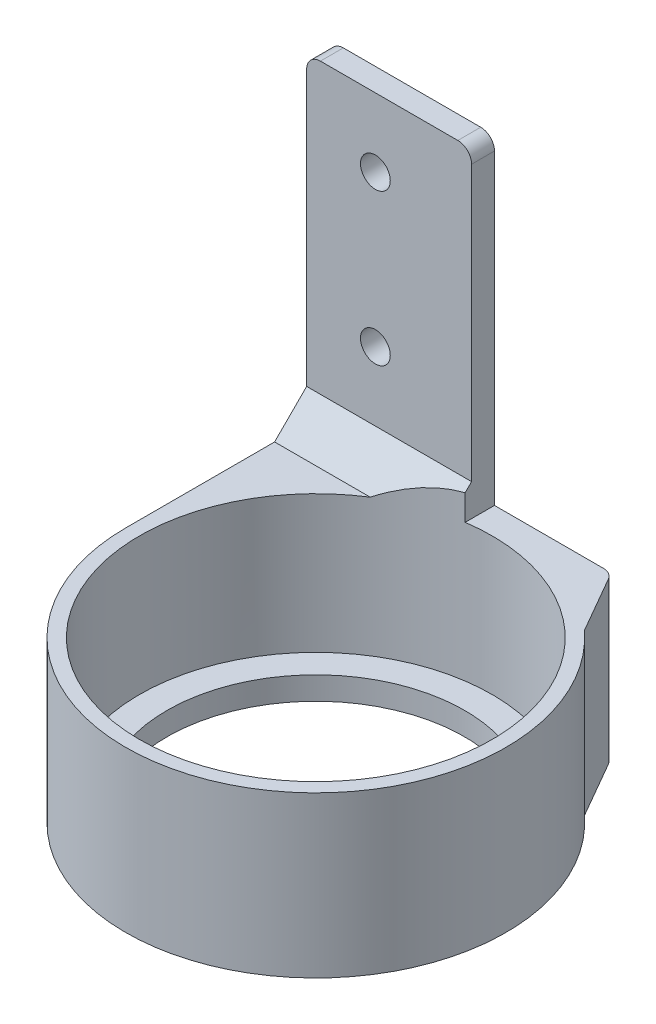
SolidWorks part; units mm, degrees
ref_plane "Ebene vorne" through (0, 0, 0) normal (0, 0, 1) x (1, 0, 0)
ref_plane "Ebene oben" through (0, 0, 0) normal (0, 1, 0) x (1, 0, 0)
ref_plane "Ebene rechts" through (0, 0, 0) normal (1, 0, 0) x (0, 0, -1)
sketch "Skizze1" plane through (0, 0, 0) normal (0, 0, 1) x (1, 0, 0)
  line L0 (18, 0) -> (18, -105) construction
  line L1 (3, 0) -> (33, 0)
  line L2 (0, -3) -> (0, -97)
  line L3 (3, -105) -> (33, -105)
  line L4 (36, -3) -> (36, -97)
  line L5 (0, -63) -> (36, -63) construction
  line L6 (33, -105) -> (36, -105)
  line L7 (36, -105) -> (36, -97)
  line L8 (0, -97) -> (0, -105)
  line L9 (0, -105) -> (3, -105)
  circle A2 centre (15, -15) radius 3.25
  circle A3 centre (15, -48) radius 3.25
  arc A6 (3, 0) -> (0, -3) centre (3, -3) ccw
  arc A7 (33, 0) -> (36, -3) centre (33, -3) cw
  point P18 (36, -105)
  point P21 (0, 0)
  point P24 (36, 0)
  dimension "D3" = 15
  dimension "D4" = 15
  dimension "D5" = 6.5
  dimension "D6" = 6.5
  dimension "D7" = 15
  dimension "D1" = 36
  dimension "D2" = 105
  dimension "D8" = 42
  dimension "D9" = 15
extrude "Aufsatz-Linear austragen1" add sketch "Skizze1" along normal blind 3
sketch "Skizze4" plane through (0, -105, 0) normal (0, -1, 0) x (1, 0, 0)
  line L0 (0, 3) -> (36, 3) construction
  line L1 (0, -20.5722) -> (0, 101.0705) construction
  line L2 (41.5, 44.5) -> (-50.319, 44.5) construction
  circle A0 centre (41.5, 44.5) radius 41.5
  point P7 (0, 44.5)
other "AusrichtungGruppe1" parameters "D1"=51.6821, "D2"=82, "D3"=82
extrude "Aufsatz-Linear austragen2" add sketch "Skizze4" against normal blind 35 separate body
sketch "Skizze6" plane through (0, -105, 0) normal (0, -1, 0) x (-1, 0, 0)
  circle A0 centre (-41.5, -44.5) radius 38.5
  dimension "D1" = 77
extrude "Schnitt-Linear austragen1" cut sketch "Skizze6" against normal through all
sketch "Skizze7" plane through (0, -70, 0) normal (0, 1, 0) x (1, 0, 0)
  circle A0 centre (41.5, -44.5) radius 32.5
  dimension "D1" = 65
extrude "Linear-Austragen-Dünn1" add sketch "Skizze7" against normal blind 5 from offset 30 thin
sketch "Skizze16" plane through (0, 0, 0) normal (0, 0, -1) x (-1, 0, 0)
  line L0 (0, -70) -> (-83, -70) construction
  line L1 (-36, -105) -> (-61.5, -105)
  line L2 (-36, -105) -> (-36, -70)
  line L3 (-36, -70) -> (-61.5, -70)
  line L4 (-61.5, -105) -> (-61.5, -70)
  dimension "D1" = 25.5
extrude "Aufsatz-Linear austragen3" add sketch "Skizze16" against normal blind 3
sketch "Skizze17" plane through (0, -105, 0) normal (0, -1, 0) x (1, 0, 0)
  line L0 (41.5, 12) -> (41.5, -5.5591) construction
  line L2 (65.4633, 10.6177) -> (69.4531, 13.8263)
  line L3 (61.1577, 7.9511) -> (65.4633, 10.6177)
  line L4 (56.4564, 5.7888) -> (61.1577, 7.9511)
  line L5 (51.631, 4.2556) -> (56.4564, 5.7888)
  line L6 (46.5811, 3.3122) -> (51.631, 4.2556)
  line L7 (46.5811, 3.3122) -> (41.5, 3)
  line L8 (0, 3) -> (61.5, 3) construction
  line L10 (61.5, 3) -> (41.5, 3)
  line L11 (69.4531, 13.8263) -> (61.5, 0)
  line L12 (61.5, 0) -> (61.5, 3)
  line L13 (41.5, 3) -> (61.5, 3)
  circle A0 centre (41.5, 44.5) radius 32.5 construction
  circle A1 centre (41.5, 44.5) radius 41.5 construction
  point P10 (46.5811, 3.3122)
  point P11 (51.631, 4.2556)
  point P12 (56.4564, 5.7888)
  point P13 (61.1577, 7.9511)
  point P14 (65.4633, 10.6177)
extrude "Aufsatz-Linear austragen4" add sketch "Skizze17" against normal blind 35
sketch "Skizze19" plane through (0, -105, 0) normal (0, -1, 0) x (1, 0, 0)
  line L2 (0, 44.5) -> (0.2928, 39.5792)
  line L3 (0.2928, 39.5792) -> (1.3201, 34.116)
  line L4 (1.3201, 34.116) -> (2.9875, 29.0393)
  line L5 (2.9875, 29.0393) -> (5.4052, 24.0204)
  line L6 (5.4052, 24.0204) -> (8.4399, 19.4145)
  line L7 (8.4399, 19.4145) -> (12.0006, 15.3103)
  line L8 (12.0006, 15.3103) -> (16.1589, 11.6355)
  line L9 (16.1589, 11.6355) -> (20.6222, 8.6341)
  line L10 (20.6222, 8.6341) -> (25.5345, 6.1939)
  line L11 (25.5345, 6.1939) -> (30.6999, 4.43)
  line L12 (30.6999, 4.43) -> (36.0384, 3.361)
  line L13 (36.0384, 3.361) -> (41.5, 3)
  line L14 (0, 3) -> (0, 44.5)
  line L15 (41.5, 3) -> (0, 3)
  circle A0 centre (41.5, 44.5) radius 41.5 construction
  point P7 (36.0384, 3.361)
  point P10 (30.6999, 4.43)
  point P11 (25.5345, 6.1939)
  point P12 (20.6222, 8.6341)
  point P13 (16.1589, 11.6355)
  point P14 (12.0006, 15.3103)
  point P15 (8.4399, 19.4145)
  point P16 (5.4052, 24.0204)
  point P17 (2.9875, 29.0393)
  point P18 (1.2971, 34.2053)
  point P19 (0.2928, 39.5792)
extrude "Aufsatz-Linear austragen5" add sketch "Skizze19" against normal blind 35
sketch3d "3D-Skizze1"
  point P0 (41.7889, -78.459, 85.999)
ref_plane "Ebene1" through (0, 0, 85.999) normal (0, 0, 1) x (1, 0, 0)
sketch "Skizze20" plane through (0, 0, 85.999) normal (0, 0, 1) x (1, 0, 0)
  line L0 (83, -70) -> (0, -70) construction
  line L3 (0, -105) -> (83, -105) construction
  line L5 (-44.701, -98) -> (109.682, -98) construction
  line L31 (-30.7141, -77) -> (172.708, -77) construction
  line L32 (-23.44, -98) -> (16.56, -98)
  line L57 (16.56, -98) -> (-3.44, -77)
  line L64 (21.56, -77) -> (21.56, -98) construction
  line L65 (-3.44, -77) -> (-23.44, -98)
  line L67 (-3.44, -77) -> (-3.44, -98) construction
  line L74 (21.56, -98) -> (41.56, -77)
  line L75 (41.56, -77) -> (1.56, -77)
  line L76 (1.56, -77) -> (21.56, -98)
  line L90 (66.56, -98) -> (26.56, -98)
  line L91 (26.56, -98) -> (46.56, -77)
  line L92 (46.56, -77) -> (46.56, -98) construction
  line L93 (46.56, -77) -> (66.56, -98)
  line L94 (51.56, -77) -> (91.56, -77)
  line L95 (71.56, -98) -> (51.56, -77)
  line L96 (71.56, -77) -> (71.56, -98) construction
  line L97 (91.56, -77) -> (71.56, -98)
  line L98 (76.56, -98) -> (116.56, -98)
  line L99 (96.56, -77) -> (76.56, -98)
  line L100 (96.56, -77) -> (96.56, -98) construction
  line L101 (116.56, -98) -> (96.56, -77)
  line L102 (141.56, -77) -> (101.56, -77)
  line L103 (101.56, -77) -> (121.56, -98)
  line L104 (121.56, -77) -> (121.56, -98) construction
  line L105 (121.56, -98) -> (141.56, -77)
  line L106 (126.56, -98) -> (141.56, -98)
  line L107 (126.56, -98) -> (146.56, -77)
  line L108 (146.56, -77) -> (146.56, -98)
  line L109 (146.56, -98) -> (141.56, -98)
  dimension "D1" = 7
  dimension "D2" = 40
  dimension "D3" = 5
  dimension "D4" = 7
  dimension "D5" = 5
  dimension "D6" = 40
  dimension "D7" = 5
  dimension "D8" = 5
wrap "Umwickeln1" [suppressed] sketch "Skizze20" source sketch "Skizze20" thickness 5 parameters "D1"=5
sketch "Skizze21" plane through (0, -70, 0) normal (0, 1, 0) x (1, 0, 0)
  line L10 (55.4486, 0) -> (59.7647, 0)
  line L11 (36, 0) -> (61.5, 0) construction
  line L12 (62.3652, -1.5042) -> (64.3465, -4.9487)
  line L13 (69.4531, -13.8263) -> (61.5, 0) construction
  line L14 (64.3465, -4.9487) -> (55.4486, 0)
  line L15 (59.7647, 0) -> (61.5, 0)
  line L16 (61.5, 0) -> (62.3652, -1.5042)
  arc A0 (59.7647, 0) -> (62.3652, -1.5042) centre (59.7647, -3) cw
  point P12 (61.5, 0)
  dimension "D1" = 3
extrude "Schnitt-Linear austragen3" cut sketch "Skizze21" against normal through all contours A0 M4 M3
sketch "Skizze23" plane through (0, 0, 0) normal (0, 0, -1) x (-1, 0, 0)
  line L0 (-15, -15) -> (-15, -48) construction
  line L1 (-36, -70) -> (0, -70) construction
sketch "Skizze24" [suppressed] plane through (0, 0, 0) normal (-1, 0, 0) x (0, 0, 1)
  line L0 (79.7239, -125) -> (0, -125) construction
  line L1 (0, -3) -> (0, -132) construction
  line L2 (0, -74) -> (77.1095, -74) construction
  line L9 (78.7288, -125) -> (44.748, -125) construction
  line L10 (68.2191, -74) -> (86, -74) construction
  line L11 (19.748, -74) -> (59.748, -74)
  line L15 (19.748, -74) -> (39.748, -125)
  line L16 (39.748, -125) -> (59.748, -74)
  line L18 (39.748, -125) -> (39.748, -74) construction
  line L19 (14.748, -74) -> (14.748, -125)
  line L20 (14.748, -74) -> (34.748, -125)
  line L21 (14.748, -125) -> (34.748, -125)
  point P12 (14.748, -74)
  dimension "D1" = 5
  dimension "D2" = 20
  dimension "D3" = 20
  dimension "D4" = 4.2062
  dimension "D5" = 5
  dimension "D6" = 5
extrude "Schnitt-Linear austragen4" [suppressed] cut sketch "Skizze24" against normal blind 15
sketch "Skizze29" plane through (0, 0, 3) normal (0, 0, 1) x (1, 0, 0)
  line L1 (3, 0) -> (33, 0)
  line L2 (0, -3) -> (0, -70)
  line L3 (0, -70) -> (36, -70)
  line L4 (36, -3) -> (36, -70)
  arc A0 (33, 0) -> (36, -3) centre (33, -3) cw
  arc A1 (3, 0) -> (0, -3) centre (3, -3) ccw
  circle A2 centre (15, -15) radius 3.25
  circle A3 centre (15, -48) radius 3.25
  point P10 (0, 0)
  dimension "D1" = 3
extrude "Aufsatz-Linear austragen8" add sketch "Skizze29" along normal blind 2
sketch "Skizze26" plane through (0, 0, 0) normal (-1, 0, 0) x (0, 0, 1)
  line L5 (5, -70) -> (5, -63)
  line L6 (5, -3) -> (5, -70) construction
  line L7 (5, -70) -> (12, -70)
  line L8 (44.5, -70) -> (5, -70) construction
  line L9 (5, -63) -> (12, -70)
  dimension "D1" = 7
  dimension "D2" = 7
extrude "Aufsatz-Linear austragen6" add sketch "Skizze26" against normal blind 36
sketch "Skizze31" plane through (0, -70, 0) normal (0, 1, 0) x (1, 0, 0)
  circle A0 centre (41.5, -44.5) radius 38.5
extrude "Schnitt-Linear austragen5" cut sketch "Skizze31" along normal blind 10
